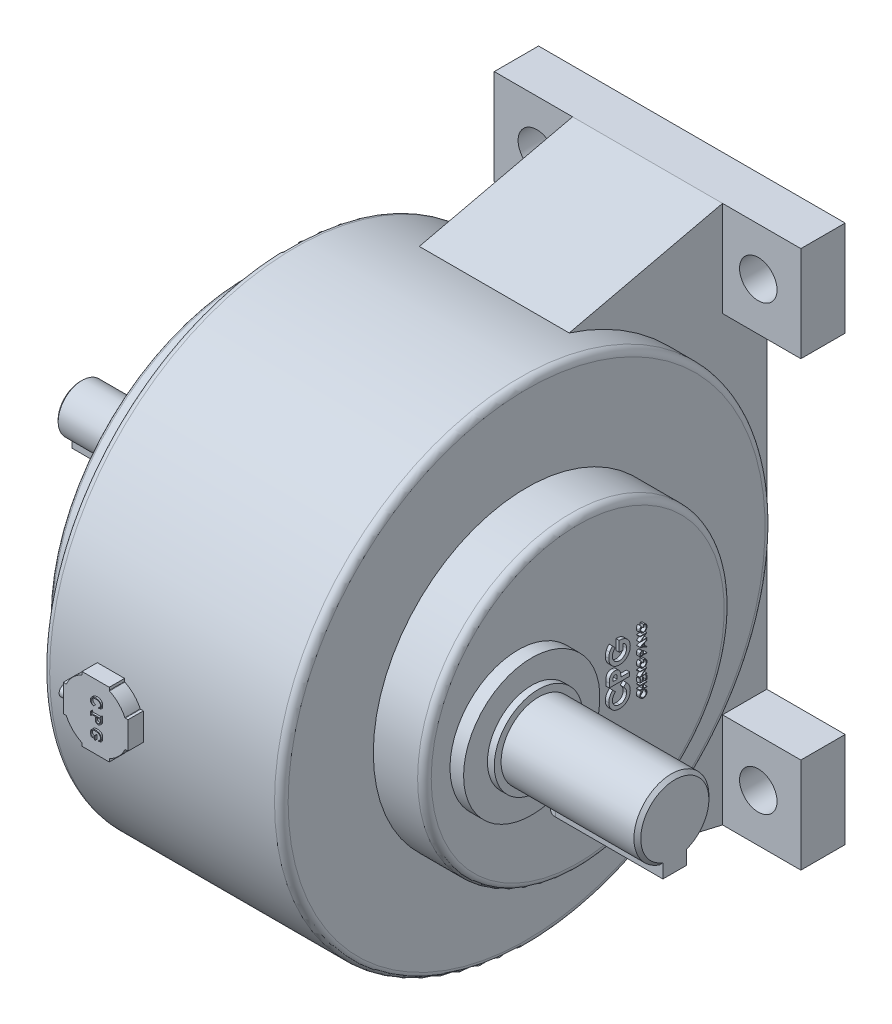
SolidWorks part; units mm, degrees
ref_plane "前视基准面" through (0, 0, 0) normal (0, 0, 1) x (1, 0, 0)
ref_plane "上视基准面" through (0, 0, 0) normal (0, 1, 0) x (1, 0, 0)
ref_plane "右视基准面" through (0, 0, 0) normal (1, 0, 0) x (0, 0, -1)
ref_plane "基准面1" through (0, 0, -97.5) normal (0, 0, 1) x (1, 0, 0)
sketch "草图1" plane through (0, 0, 0) normal (0, 1, 0) x (1, 0, 0)
  line L0 (0, 0) -> (33.1729, 0) construction
  line L1 (0, 0) -> (0, -11)
  line L2 (0, -11) -> (-40, -11)
  line L3 (-40, -11) -> (-40, -13)
  line L4 (-40, -13) -> (-42, -13)
  line L5 (-42, -13) -> (-42, -20)
  line L6 (-42, -20) -> (-46, -20)
  line L7 (-46, -20) -> (-46, 0)
  line L8 (-46, 0) -> (0, 0)
  dimension "D1" = 40
  dimension "D2" = 22
  dimension "D3" = 26
  dimension "D4" = 2
  dimension "D5" = 40
  dimension "D6" = 4
revolve "旋转1" add sketch "草图1" angle 360 about L0
sketch "草图2" plane through (0, 0, 0) normal (0, 1, 0) x (1, 0, 0)
  line L0 (8.0167, 17.5) -> (-46, 17.5) construction
  line L1 (-46, 17.5) -> (-46, -27.5)
  line L2 (-46, 20) -> (-46, -20) construction
  line L3 (-46, -27.5) -> (-61, -27.5)
  line L4 (-61, -27.5) -> (-61, -54.5)
  line L5 (-61, -54.5) -> (-131, -54.5)
  line L6 (-131, -54.5) -> (-131, 17.5)
  line L11 (-46, 17.5) -> (-131, 17.5)
  line L13 (-103.125, 97.5) -> (103.125, 97.5) construction
  dimension "D1" = 17.5
  dimension "D2" = 90
  dimension "D3" = 15
  dimension "D4" = 152
  dimension "D5" = 70
revolve "旋转2" add sketch "草图2" angle 360 about L0
sketch "草图3" plane through (0, 0, -97.5) normal (0, 0, 1) x (1, 0, 0)
  line L0 (0, 0) -> (40.0459, 0) construction
  line L1 (-137.5, -51) -> (-47.5, -51)
  line L2 (-137.5, -51) -> (-137.5, -79)
  line L3 (-137.5, -79) -> (-47.5, -79)
  line L4 (-47.5, -51) -> (-47.5, -79)
  line L5 (0, -11) -> (0, 11) construction
  circle A0 centre (-60, -65) radius 5.5
  circle A1 centre (-125, -65) radius 5.5
  dimension "D2" = 130
  dimension "D3" = 11
  dimension "D4" = 65
  dimension "D6" = 60
  dimension "D8" = 28
  dimension "D1" = 158
  dimension "D5" = 90
  dimension "D7" = 12.5
extrude "拉伸2" add sketch "草图3" along normal blind 13
mirror "镜向2" about plane through (0, 0, 0) normal (0, 1, 0)
ref_plane "基准面4" through (-92.5, 0, 0) normal (1, 0, 0) x (0, 0, -1)
sketch "草图4" plane through (-92.5, 0, 0) normal (1, 0, 0) x (0, 0, -1)
  line L0 (84.5, 51) -> (97.5, 51) construction
  line L1 (84.5, 51) -> (97.5, 51)
  line L2 (84.5, 79) -> (84.5, 51) construction
  line L3 (84.5, 79) -> (84.5, 51)
  line L4 (84.5, -51) -> (97.5, -51) construction
  line L5 (84.5, -51) -> (97.5, -51)
  line L6 (84.5, -79) -> (84.5, -51) construction
  line L7 (84.5, -79) -> (84.5, -51)
  line L8 (97.5, 51) -> (97.5, -51)
  line L9 (84.5, 79) -> (39.5, 68.5565)
  line L11 (39.5, -68.5565) -> (84.5, -79)
  arc A1 (39.5, -68.5565) -> (39.5, 68.5565) centre (17.5, 0) ccw
  circle A2 centre (17.5, 0) radius 72 construction
  dimension "D1" = 45
extrude "拉伸3" add sketch "草图4" against normal mid plane 44
sketch "草图5" plane through (0, 0, 0) normal (0, 1, 0) x (1, 0, 0)
  line L0 (0, -3.5) -> (-31.5, -3.5)
  line L1 (0, -11) -> (0, 11) construction
  line L2 (-31.5, 3.5) -> (0, 3.5)
  line L3 (0, 3.5) -> (0, -3.5)
  line L4 (25, -13.7955) -> (25, 19.6443) construction
  arc A0 (-31.5, -3.5) -> (-31.5, 3.5) centre (-31.5, 0) cw
  dimension "D2" = 35
  dimension "D1" = 7
  dimension "D3" = 25
extrude "拉伸4" add sketch "草图5" against normal blind 13.5
fillet "圆角1" radius 2 3 edges at (-131, 0, -89.5) (-61, 0, -89.5) (-46, 0, -62.5)
chamfer "倒角1" distance 1 angle 45 1 edges at (0, 11, 0)
sketch "草圖2"
  dimension "D1" = 5
extrude "伸長1" add sketch "草圖2" along normal blind 1
sketch "草圖3" plane through (0, 0, 0) normal (0, 1, 0) x (1, 0, 0)
  line L0 (-168.5, 24.5) -> (-191.5, 24.5)
  line L1 (-191.5, 24.5) -> (-192, 24)
  line L2 (-192, 24) -> (-192, 17.5)
  line L3 (-165, 42.7) -> (-165, 24.75)
  line L4 (-167, 24.45) -> (-168.5, 24.45)
  line L5 (-167, 24.45) -> (-166.5, 24.75)
  line L6 (-166.5, 24.75) -> (-165, 24.75)
  line L7 (-131.0758, 75.5) -> (-142.2, 75.5)
  line L8 (-156.3476, 43.5) -> (-164.2, 43.5)
  line L9 (-143.3797, 51.5851) -> (-155.7273, 43.7156)
  line L10 (-226.598, 17.5) -> (-77.5909, 17.5) construction
  line L11 (-131, 75.2866) -> (-131, 17.5)
  line L13 (-192, 17.5) -> (-131, 17.5)
  line L14 (-143, 74.7) -> (-143, 52.3695)
  line L15 (-168.5, 24.5) -> (-168.5, 24.45)
  arc A0 (-164.2, 43.5) -> (-165, 42.7) centre (-164.2, 42.7) ccw
  arc A3 (-156.3476, 43.5) -> (-155.7273, 43.7156) centre (-156.3476, 44.5) ccw
  arc A6 (-143.3797, 51.5851) -> (-143, 52.3695) centre (-144, 52.3695) ccw
  arc A7 (-142.2, 75.5) -> (-143, 74.7) centre (-142.2, 74.7) ccw
  arc A8 (-131, 75.2866) -> (-131.0758, 75.5) centre (-131.3385, 75.2866) ccw
  dimension "D1" = 17.5
  dimension "D2" = 116
  dimension "D3" = 14
  dimension "D4" = 25
  dimension "D5" = 12
  dimension "D6" = 192
revolve "旋轉1" add sketch "草圖3" angle 360 about L10
sketch "草圖4" plane through (0, 0, 0) normal (0, 1, 0) x (1, 0, 0)
  line L0 (-161.2069, 17.5) -> (-198.933, 17.5) construction
  line L1 (-192, 15) -> (-172.5, 15)
  line L2 (-168.5, 24.5) -> (-191.5, 24.5) construction
  line L3 (-172.5, 20) -> (-192, 20)
  line L4 (-192, 20) -> (-192, 15)
  line L5 (-170, 17.5) -> (-170, 2.7053) construction
  line L7 (-156.5222, -1.4625) -> (-156.4241, -1.5115) construction
  arc A0 (-172.5, 15) -> (-172.5, 20) centre (-172.5, 17.5) ccw
  dimension "D1" = 22
  dimension "D2" = 5
  dimension "D3" = 2.5
  dimension "D4" = 7
extrude "伸長2" add sketch "草圖4" against normal blind 9.2
ref_plane "平面1" through (0, 0, 59) normal (0, 0, 1) x (1, 0, 0)
sketch "草圖5" plane through (0, 0, 59) normal (0, 0, 1) x (1, 0, 0)
  line L0 (-115, 9.5) -> (-107, 9.5)
  line L2 (-115, 8.7121) -> (-115, 9.5)
  line L3 (-107, 8.7121) -> (-107, 9.5)
  line L4 (-119.7121, 4) -> (-120.5, 4)
  line L5 (-119.7121, -4) -> (-120.5, -4)
  line L6 (-120.5, -4) -> (-120.5, 4)
  line L7 (-115, -8.7121) -> (-115, -9.5)
  line L8 (-107, -8.7121) -> (-107, -9.5)
  line L9 (-107, -9.5) -> (-115, -9.5)
  line L10 (-102.2879, -4) -> (-101.5, -4)
  line L11 (-102.2879, 4) -> (-101.5, 4)
  line L12 (-101.5, 4) -> (-101.5, -4)
  arc A0 (-115.0855, 8.5766) -> (-119.5766, 4.0855) centre (-111, 0) ccw
  arc A1 (-115.0855, 8.5766) -> (-115, 8.7121) centre (-115.15, 8.7121) ccw
  arc A2 (-107, 8.7121) -> (-106.9145, 8.5766) centre (-106.85, 8.7121) ccw
  arc A3 (-119.7121, 4) -> (-119.5766, 4.0855) centre (-119.7121, 4.15) ccw
  arc A4 (-119.5766, -4.0855) -> (-119.7121, -4) centre (-119.7121, -4.15) ccw
  arc A5 (-115, -8.7121) -> (-115.0855, -8.5766) centre (-115.15, -8.7121) ccw
  arc A6 (-106.9145, -8.5766) -> (-107, -8.7121) centre (-106.85, -8.7121) ccw
  arc A7 (-102.2879, -4) -> (-102.4234, -4.0855) centre (-102.2879, -4.15) ccw
  arc A8 (-102.4234, 4.0855) -> (-102.2879, 4) centre (-102.2879, 4.15) ccw
  arc A9 (-119.5766, -4.0855) -> (-115.0855, -8.5766) centre (-111, 0) ccw
  arc A10 (-106.9145, -8.5766) -> (-102.4234, -4.0855) centre (-111, 0) ccw
  arc A11 (-102.4234, 4.0855) -> (-106.9145, 8.5766) centre (-111, 0) ccw
extrude "伸長3" add sketch "草圖5" against normal blind 4.5 separate body
sketch "草圖6"
extrude "伸長4" add sketch "草圖6" along normal blind 0.5
sketch "草圖7" plane through (0, 0, 0) normal (0, 1, 0) x (1, 0, 0)
  line L0 (-119.4836, -55.7307) -> (-115.814, -55.9345)
  line L1 (-121.1145, -55.7307) -> (-119.4836, -55.7307)
  line L2 (-121.1145, -55.7307) -> (-121.1145, -55.1191)
  line L3 (-122.3376, -55.1191) -> (-121.1145, -55.1191)
  line L4 (-115.814, -56.75) -> (-115.814, -55.9345)
  line L5 (-115.814, -56.75) -> (-122.3376, -56.75)
  line L6 (-122.3376, -55.1191) -> (-122.3376, -56.75)
revolve "旋轉2" add sketch "草圖7" angle 360 about L5
equation "\"D7@草图3\" =  ( \"D5@草图3\"-\"D4@草图3\"  )  / 2"
equation "\"D8@草图3\" =  \"D1@草图3\"-\"D2@草图3\""
equation "\"D1@拉伸4\" =\"D3@草图5\"-\"D2@草图1\"/2"
equation "\"D3@草图1\" = \"D2@草图1\"+4"
equation "\"D5@草图2\" = \"D4@草图3\"+5"
equation "\"D1@基准面4\" =\"D5@草图3\"/2"
equation "\"D1@拉伸3\" = \"D4@草图3\"-\"D3@草图3\" - 10"
